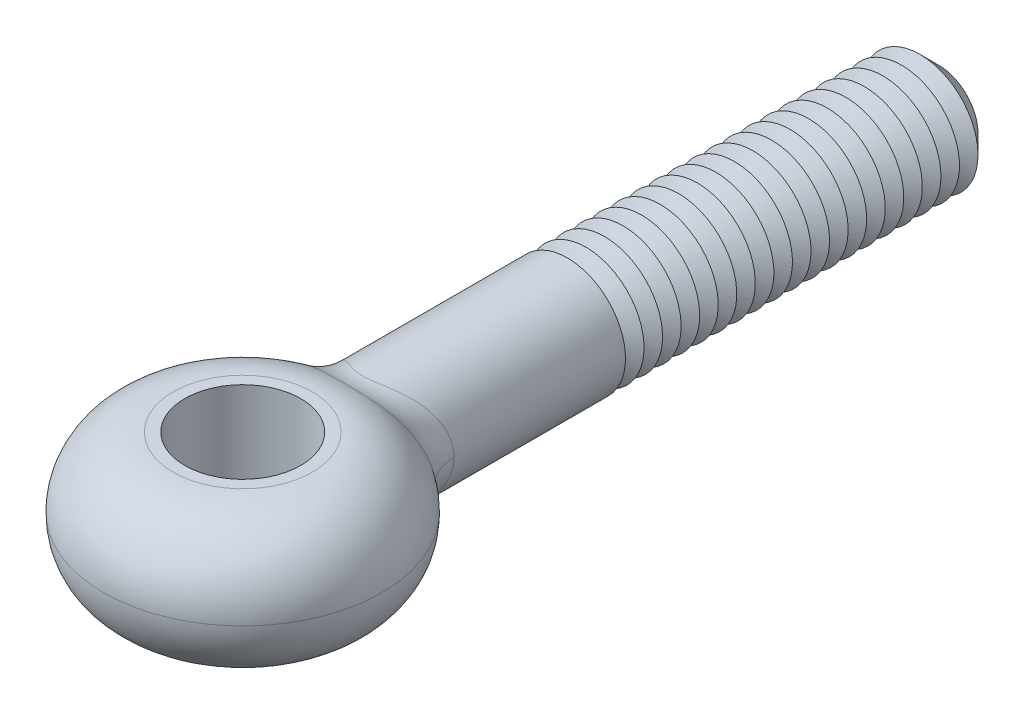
SolidWorks part; units mm, degrees
ref_plane "Front Plane" through (0, 0, 0) normal (0, 0, 1) x (1, 0, 0)
ref_plane "Top Plane" through (0, 0, 0) normal (0, 1, 0) x (1, 0, 0)
ref_plane "Right Plane" through (0, 0, 0) normal (1, 0, 0) x (0, 0, -1)
sketch "Sketch7" plane through (0, 0, 0) normal (0, 1, 0) x (1, 0, 0)
  circle A0 centre (0, 0) radius 6
  dimension "D1" = 12
extrude "Boss-Extrude3" add sketch "Sketch7" along normal mid plane 6
sketch "Sketch8" plane through (0, 0, 0) normal (0, 0, 1) x (1, 0, 0)
  circle A0 centre (0, 0) radius 2.5
  dimension "D1" = 5
extrude "Boss-Extrude4" add sketch "Sketch8" against normal blind 30
fillet "Fillet5" radius 3 2 edges at (0, -3, 6) (0, 3, 6)
fillet "Fillet6" radius 2 2 edges at (0.0752, -2.4989, -4.6594) (-0.0752, 2.4989, -4.6594)
chamfer "Chamfer1" distance 0.8 angle 45 1 edges at (2.5, 0, -30)
sketch "Sketch10" plane through (0, 0, 0) normal (0, 1, 0) x (1, 0, 0)
  line L0 (0, 28.1405) -> (0, -7.9233) construction
sketch "Sketch11" plane through (0, 0, 0) normal (0, 1, 0) x (1, 0, 0)
  line L0 (-2.5, 14) -> (-1.8072, 14.4)
  line L1 (-2.5, 29.2) -> (-2.5, 6.6144) construction
  line L2 (-1.8072, 14.4) -> (-2.5, 14.8)
  line L3 (-2.5, 14.8) -> (-2.5, 14)
  line L4 (1.7, 30) -> (-1.7, 30) construction
  dimension "D1" = 0.8
  dimension "D2" = 16
revolve "Cut-Revolve1" cut sketch "Sketch11" angle 360 about L0
pattern_linear "LPattern1" count 19 spacing 0.8 along (0, 0, -1) of "Cut-Revolve1"
sketch "Sketch12" plane through (0, 0, 0) normal (0, 1, 0) x (1, 0, 0)
  circle A0 centre (0, 0) radius 2.5
  dimension "D1" = 5
extrude "Cut-Extrude1" cut sketch "Sketch12" against normal mid plane 6
